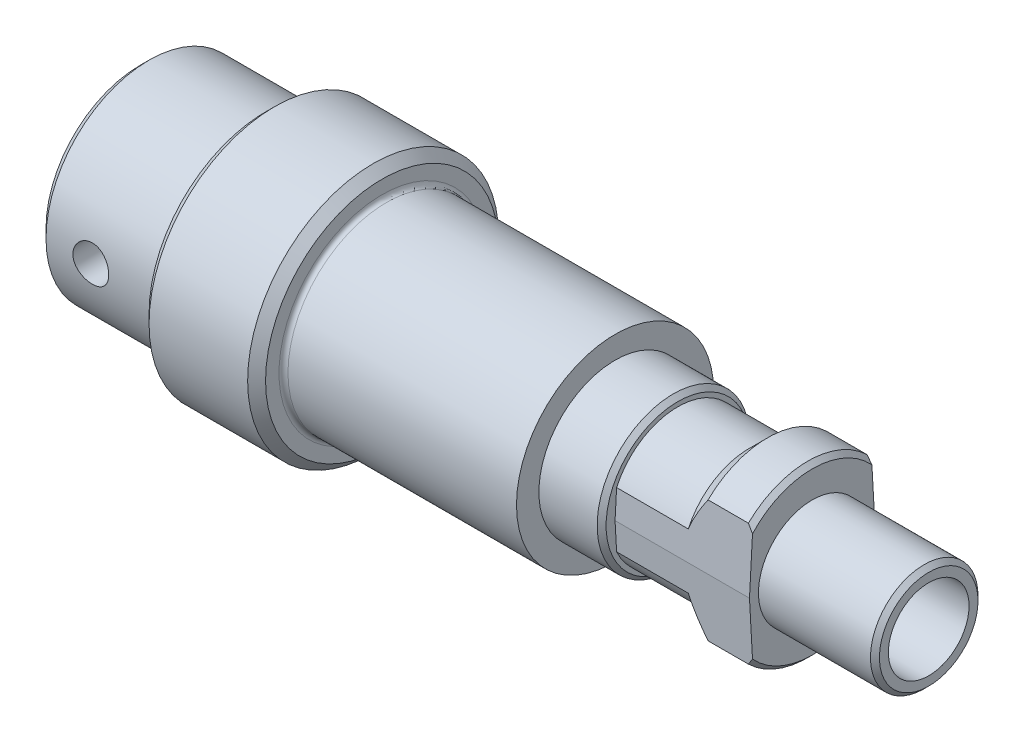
SolidWorks part; units mm, degrees
ref_plane "Plane1" through (0, 0, 0) normal (0, 0, 1) x (1, 0, 0)
ref_plane "Plane2" through (0, 0, 0) normal (0, 1, 0) x (1, 0, 0)
ref_plane "Plane3" through (0, 0, 0) normal (1, 0, 0) x (0, 0, -1)
sketch "Esquisse1" plane through (0, 0, 0) normal (0, 0, 1) x (1, 0, 0)
  line L0 (0, 4.5) -> (0, 6)
  line L1 (0, 6) -> (-13, 6)
  line L2 (-13, 6) -> (-13, 9.5)
  line L3 (-13, 9.5) -> (-18, 9.5)
  line L4 (-18, 9.5) -> (-20, 7.5)
  line L5 (-20, 7.5) -> (-28, 7.5)
  line L6 (-61, 11) -> (-61, 14)
  line L7 (-35, 8.5) -> (-28.5, 8.5)
  line L8 (-88, 8.5) -> (-76, 8.5)
  line L9 (-35, 8.5) -> (-35, 11)
  line L10 (-35, 11) -> (-61, 11)
  line L11 (-61, 14) -> (-74, 14)
  line L12 (-66, 4.5) -> (0, 4.5)
  line L13 (-74, 14) -> (-74, 11.5)
  line L14 (-74, 11.5) -> (-88, 11.5)
  line L15 (-88, 11.5) -> (-88, 8.5)
  line L16 (11, 0) -> (-102, 0) construction
  line L17 (-28, 7.5) -> (-28, 8)
  line L18 (-28, 8) -> (-28.5, 8.5)
  line L19 (-76, 8.5) -> (-76, 6)
  line L20 (-76, 6) -> (-66, 6)
  line L21 (-66, 6) -> (-66, 4.5)
  dimension "D1" = 6
  dimension "D2" = 4.5
  dimension "D3" = 9.5
  dimension "D4" = 7.5
  dimension "D5" = 8.5
  dimension "D6" = 11
  dimension "D7" = 13
  dimension "D8" = 18
  dimension "D9" = 2
  dimension "D10" = 28
  dimension "D11" = 0.5
  dimension "D12" = 35
  dimension "D13" = 61
  dimension "D14" = 14
  dimension "D15" = 11.5
  dimension "D16" = 88
  dimension "D17" = 14
  dimension "D18" = 8.5
  dimension "D19" = 6
  dimension "D20" = 12
  dimension "D21" = 22
revolve "Base-Révolution" add sketch "Esquisse1" angle 360 about L16
chamfer "Chanfrein1" distance 1 angle 45
fillet "Congé1" radius 0.5
chamfer "Chanfrein2" distance 0.5 angle 45
sketch "Esquisse2" plane through (-13, 0, 0) normal (1, 0, 0) x (0, 0, -1)
  line L0 (-7, 0) -> (-6.5, 9)
  line L1 (14, -9) -> (6.5, -9)
  line L2 (0, 0) -> (0, 6) construction
  line L3 (0, 0) -> (5, 0) construction
  line L4 (7, 0) -> (6.5, 9)
  line L5 (7, 0) -> (6.5, -9)
  line L6 (14, 9) -> (14, -9)
  line L7 (-7, 0) -> (-6.5, -9)
  line L8 (-6.5, 9) -> (-14, 9)
  line L9 (-14, 9) -> (-14, -9)
  line L10 (-14, -9) -> (-6.5, -9)
  line L11 (6.5, 9) -> (14, 9)
  circle A0 centre (0, 0) radius 9 construction
  point P12 (0, 9)
  point P15 (0, -9)
  dimension "D1" = 7
  dimension "D2" = 6.5
extrude "Enlèv. mat.-Extru.1" cut sketch "Esquisse2" against normal blind 15
chamfer "Chanfrein3" distance 0.5 angle 45
ref_plane "Plan4" through (0, 0, 20) normal (0, 0, 1) x (1, 0, 0)
sketch "Esquisse3" plane through (0, 0, 20) normal (0, 0, 1) x (1, 0, 0)
  line L0 (-13.5, 0) -> (-13, 0) construction
  line L1 (-88, 10.5) -> (-88, -10.5) construction
  circle A0 centre (-82, 0) radius 2
  dimension "D1" = 4
  dimension "D2" = 6
extrude "Enlèv. mat.-Extru.2" cut sketch "Esquisse3" against normal through all
